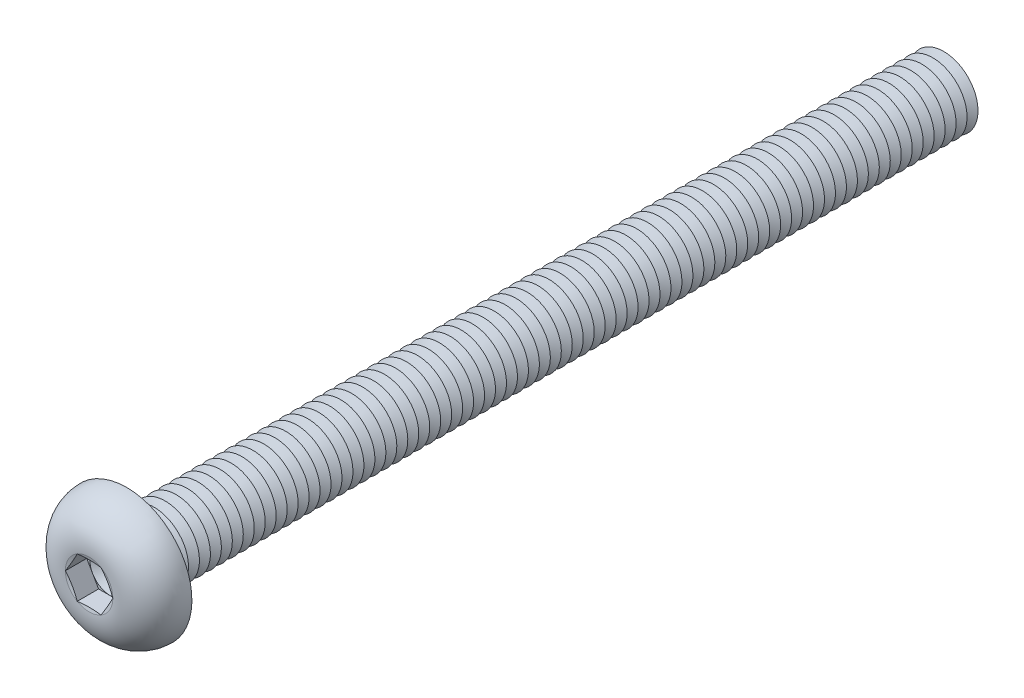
SolidWorks part; units mm, degrees
ref_plane "Front Plane" through (0, 0, 0) normal (0, 0, 1) x (1, 0, 0)
ref_plane "Top Plane" through (0, 0, 0) normal (0, 1, 0) x (1, 0, 0)
ref_plane "Right Plane" through (0, 0, 0) normal (1, 0, 0) x (0, 0, -1)
sketch "Sketch1" plane through (0, 0, 0) normal (1, 0, 0) x (0, 0, -1)
  line L0 (0, 2.5) -> (0, 4.75)
  line L3 (0, 2.5) -> (60, 2.5)
  line L4 (60, 2.5) -> (60, 0)
  line L5 (60, 0) -> (-2.75, 0) construction
  line L6 (-2.75, 0) -> (60, 0)
  line L7 (-2.75, 1.732) -> (-2.75, 0.866) construction
  line L8 (-2.75, 0.866) -> (-2.75, 0)
  line L9 (-2.75, 1.732) -> (-2.5179, 0.866)
  line L10 (-2.5179, 0.866) -> (-2.75, 0.866)
  line L11 (60, 0) -> (22.7481, 0) construction
  line L12 (0, 4.75) -> (-2.75, 4.75) construction
  arc A1 (0, 4.75) -> (-2.75, 1.732) centre (0, 1.9881) ccw
  point P8 (60, 1.25)
  dimension "D1" = 9.5
  dimension "D2" = 5
  dimension "D3" = 2.75
  dimension "D4" = 3.4641
  dimension "D5" = 60
  dimension "D6" = 15
revolve "Revolve1" add sketch "Sketch1" angle 360 about L5
fillet "Fillet1" radius 0.4 1 edges at (0, 2.5, 0)
sketch "Sketch2" plane through (0, 0, 0) normal (1, 0, 0) x (0, 0, -1)
  line L0 (59.6, 2.5) -> (60.4, 2.5)
  line L1 (60, 2.5) -> (0.4, 2.5) construction
  line L2 (60.4, 2.5) -> (60, 1.8072)
  line L3 (60, -2.5) -> (60, 2.5) construction
  line L4 (60, 1.8072) -> (59.6, 2.5)
  dimension "D1" = 0.8
revolve "Cut-Revolve1" cut sketch "Sketch2" angle 360 about axis through (0, 0, -60) along (0, 0, -1)
pattern_linear "LPattern1" count 75 spacing 0.8 along (0, 0, 1) of "Cut-Revolve1"
sketch "Sketch3" plane through (0, 0, 2.75) normal (0, 0, 1) x (1, 0, 0)
  line L7 (0.866, 1.5) -> (-0.866, 1.5)
  line L8 (-0.866, 1.5) -> (-1.7321, 0)
  line L9 (-1.7321, 0) -> (-0.866, -1.5)
  line L10 (-0.866, -1.5) -> (0.866, -1.5)
  line L11 (0.866, -1.5) -> (1.7321, 0)
  line L12 (1.7321, 0) -> (0.866, 1.5)
  circle A0 centre (0, 0) radius 1.5 construction
  circle A3 centre (0, 0) radius 1.732 construction
extrude "Cut-Extrude1" cut sketch "Sketch3" against normal blind 1.56
sketch "Sketch4" plane through (0, 0, 1.19) normal (0, 0, 1) x (1, 0, 0)
  line L1 (0.866, 1.5) -> (-0.866, 1.5) construction
  circle A0 centre (0, 0) radius 1.5
extrude "Cut-Extrude2" cut sketch "Sketch4" against normal through all draft 60
